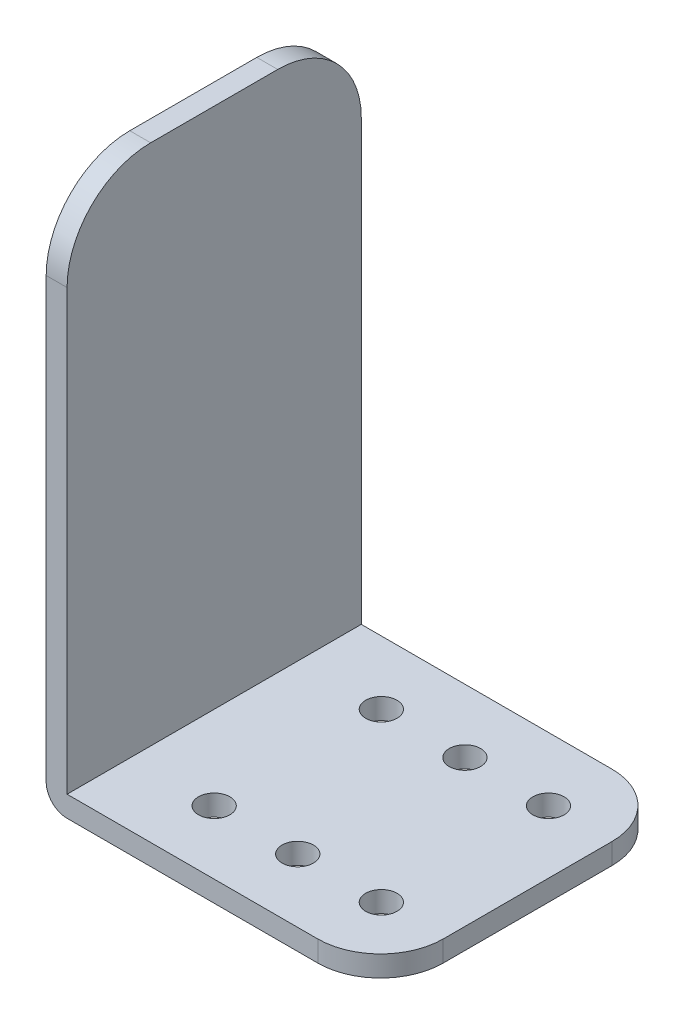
SolidWorks part; units mm, degrees
ref_plane "Front" through (0, 0, 0) normal (0, 0, 1) x (1, 0, 0)
ref_plane "Top" through (0, 0, 0) normal (0, 1, 0) x (1, 0, 0)
ref_plane "Right" through (0, 0, 0) normal (1, 0, 0) x (0, 0, -1)
sketch "Sketch2" plane through (0, 0, 0) normal (0, 0, 1) x (1, 0, 0)
  line L0 (0, 0) -> (0, -82.55)
  line L1 (0, -82.55) -> (50.8, -82.55)
  line L2 (50.8, -82.55) -> (50.8, -79.375)
  line L3 (0, 0) -> (3.175, 0)
  line L4 (3.175, 0) -> (3.175, -79.375)
  line L5 (3.175, -79.375) -> (50.8, -79.375)
  dimension "D1" = 3.175
  dimension "D2" = 3.175
  dimension "D3" = 82.55
  dimension "D4" = 50.8
extrude "Boss-Extrude2" add sketch "Sketch2" along normal blind 171.45
sketch "Sketch3" plane through (0, 0, 0) normal (-1, 0, 0) x (0, 0, 1)
  line L0 (44.704, -82.55) -> (126.746, -82.55)
  line L1 (171.45, -82.55) -> (0, -82.55) construction
  line L2 (126.746, -82.55) -> (126.746, -73.025)
  line L3 (126.746, -73.025) -> (44.704, -73.025)
  line L4 (0, 0) -> (0, -82.55) construction
  line L5 (44.704, -82.55) -> (44.704, -73.025)
  line L6 (171.45, 0) -> (171.45, -82.55) construction
  dimension "D1" = 44.704
  dimension "D2" = 9.525
  dimension "D5" = 44.704
extrude "Cut-Extrude1" cut sketch "Sketch3" against normal through all
sketch "Sketch4" plane through (0, -79.375, 0) normal (0, 1, 0) x (1, 0, 0)
  line L0 (3.175, -171.45) -> (15.875, -171.45) construction
  line L1 (50.8, -171.45) -> (3.175, -171.45) construction
  line L2 (15.875, -171.45) -> (15.875, -161.798) construction
  line L3 (15.875, -161.798) -> (41.275, -161.798) construction
  line L4 (15.875, -161.798) -> (15.875, -136.398) construction
  line L5 (15.875, -136.398) -> (41.275, -136.398) construction
  line L6 (3.175, -85.725) -> (50.8, -85.725) construction
  line L7 (3.175, -126.746) -> (3.175, -44.704) construction
  line L8 (15.875, -35.052) -> (41.275, -35.052) construction
  line L9 (15.875, -9.652) -> (15.875, -35.052) construction
  line L10 (15.875, -9.652) -> (41.275, -9.652) construction
  line L11 (15.875, 0) -> (15.875, -9.652) construction
  line L12 (3.175, 0) -> (15.875, 0) construction
  circle A0 centre (15.875, -161.798) radius 2.3813
  circle A1 centre (28.575, -161.798) radius 2.3813
  circle A2 centre (41.275, -161.798) radius 2.3812
  circle A3 centre (15.875, -136.398) radius 2.3813
  circle A4 centre (28.575, -136.398) radius 2.3813
  circle A5 centre (41.275, -136.398) radius 2.3812
  circle A6 centre (41.275, -35.052) radius 2.3812
  circle A7 centre (28.575, -35.052) radius 2.3813
  circle A8 centre (15.875, -35.052) radius 2.3813
  circle A9 centre (41.275, -9.652) radius 2.3812
  circle A10 centre (28.575, -9.652) radius 2.3813
  circle A11 centre (15.875, -9.652) radius 2.3813
  dimension "D3" = 4.7625
  dimension "D1" = 12.7
  dimension "D2" = 9.652
  dimension "D4" = 25.4
  dimension "D5" = 25.4
  dimension "D6" = 25.4
extrude "Cut-Extrude2" cut sketch "Sketch4" against normal up to next
fillet "Fillet1" radius 9.525 4 edges at (50.8, -80.9625, 0) (50.8, -80.9625, 44.704) (50.8, -80.9625, 171.45) (50.8, -80.9625, 126.746)
fillet "Fillet2" radius 3.175 2 edges at (0, -82.55, 149.098) (0, -82.55, 22.352)
fillet "Fillet3" radius 12.7 2 edges at (1.5875, 0, 0) (1.5875, 0, 171.45)
sketch "Sketch5" plane through (0, 0, 0) normal (0, 1, 0) x (1, 0, 0)
  line L0 (0, -126.746) -> (50.8, -126.746)
  line L1 (50.8, -126.746) -> (50.8, 0)
  line L2 (50.8, 0) -> (0, 0)
  line L3 (0, 0) -> (0, -126.746)
extrude "Cut-Extrude4" cut sketch "Sketch5" against normal up to next
fillet "Fillet4" radius 12.7 1 edges at (1.5875, 0, 126.746)
